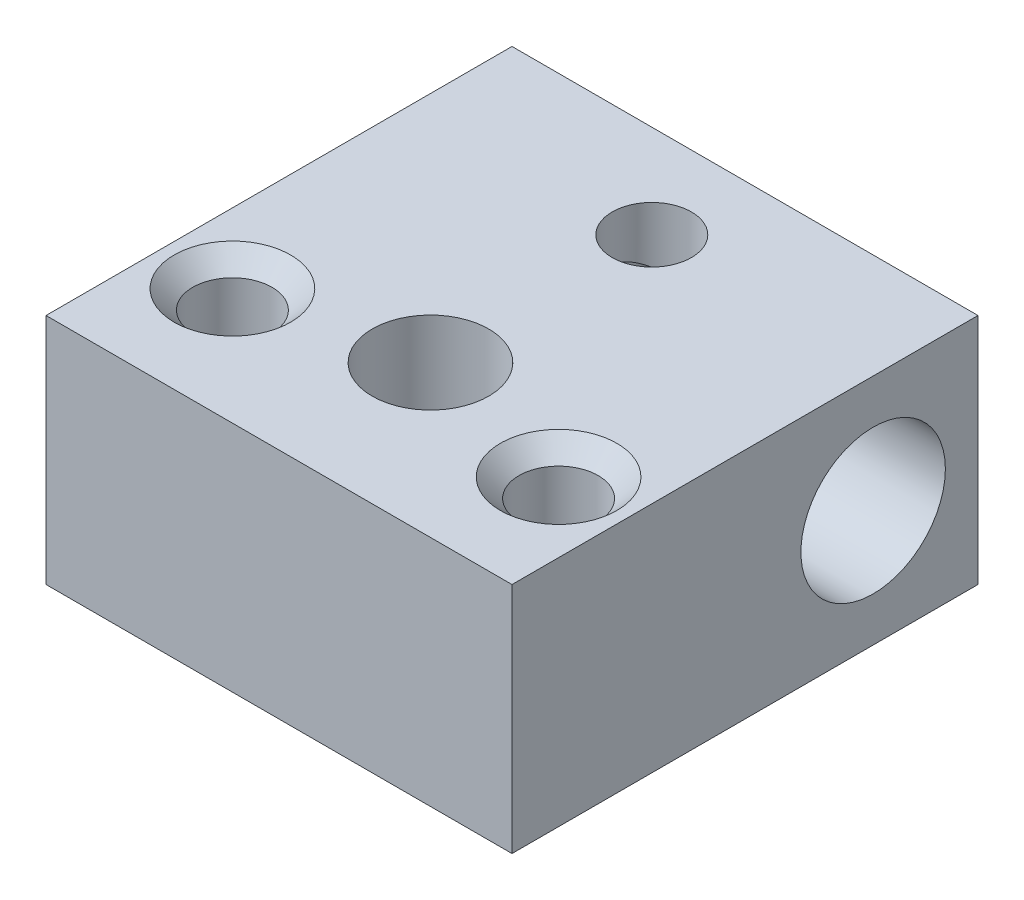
SolidWorks part; units mm, degrees
ref_plane "Alzado" through (0, 0, 0) normal (0, 0, 1) x (1, 0, 0)
ref_plane "Planta" through (0, 0, 0) normal (0, 1, 0) x (1, 0, 0)
ref_plane "Vista lateral" through (0, 0, 0) normal (1, 0, 0) x (0, 0, -1)
sketch "Croquis1" plane through (0, 0, 0) normal (0, 1, 0) x (1, 0, 0)
  line L1 (-10, -10) -> (10, -10)
  line L2 (-10, -10) -> (-10, 10)
  line L3 (-10, 10) -> (10, 10)
  line L4 (10, -10) -> (10, 10)
  line L5 (-10, -10) -> (10, 10) construction
  line L6 (-10, 10) -> (10, -10) construction
  point P0 (0, 0)
  dimension "D1" = 20
  dimension "D2" = 20
extrude "Saliente-Extruir1" add sketch "Croquis1" along normal blind 10
hole_wizard "Perforador para roscar para macho de roscar para M6x1.01" positions "Croquis4" profile "Croquis5" hole size "M6x1.0" standard "Ansi Metric"
sketch "Croquis4" plane through (0, 10, 0) normal (0, 1, 0) x (1, 0, 0)
  line L0 (-10, -10) -> (10, -10) construction
  line L1 (-10, 10) -> (-10, -10) construction
  point P0 (0, -3.5)
  dimension "D1" = 6.5
  dimension "D2" = 10
sketch "Croquis5" plane through (0, 10, 3.5) normal (1, 0, 0) x (0, 0, 1)
  line L0 (0, 0) -> (0, 10)
  line L1 (0, 10) -> (2.5, 10)
  line L2 (2.5, 10) -> (2.5, 0)
  line L5 (2.5, 0) -> (0, 0)
  line L11 (0, -6.35) -> (0, 107.95) construction
  dimension "Diámetro de taladro hasta el siguiente" = 5
  dimension "Profundidad de taladro hasta el siguiente" = 10
thread "Rosca1" pitch 1 start angle 0, offset 0, length 0, pitch 1, diameter 5
ref_plane "Plano1" through (-2.5, 10, 3.5) normal (0, 0, 1) x (-1, 0, 0)
sketch "Perfil de rosca1" plane through (-2.5, 10, 3.5) normal (0, 0, 1) x (-1, 0, 0)
  line L0 (0, 0) -> (0, 1) construction
  line L11 (0, 0) -> (0, 0.875)
  line L12 (0, 0.875) -> (-0.5413, 0.5625)
  line L13 (-0.5413, 0.5625) -> (-0.5413, 0.3125)
  line L15 (-0.5413, 0.3125) -> (0, 0)
  line L17 (-0.5413, 0.4375) -> (0, 0.4375) construction
  point P2 (0, 0)
  dimension "Pitch" = 1
  dimension "Profile_Angle" = 60
  dimension "Profile_Land" = 0.25
  dimension "Profile_Height" = 0.5413
hole_wizard "Refrentado para tornillo tapón con cabeza plana de clavija de M31" positions "Croquis8" profile "Croquis9" countersink size "M3" standard "Ansi Metric"
sketch "Croquis8" plane through (0, 10, 0) normal (0, 1, 0) x (1, 0, 0)
  line L0 (-10, -10) -> (10, -10) construction
  line L2 (-10, 10) -> (-10, -10) construction
  line L3 (10, -10) -> (10, 10) construction
  point P0 (-7, -5)
  point P2 (7, -5)
  dimension "D1" = 5
  dimension "D2" = 5
  dimension "D3" = 3
  dimension "D4" = 3
sketch "Croquis9" plane through (-7, 10, 5) normal (1, 0, 0) x (0, 0, 1)
  line L0 (0, 0) -> (0, 10)
  line L1 (0, 10) -> (1.7, 10)
  line L2 (1.7, 10) -> (1.7, 0.8)
  line L3 (1.7, 0.8) -> (2.5, 0)
  line L5 (2.5, 0) -> (0, 0)
  line L6 (-1.7, 0.8) -> (-2.5, 0) construction
  line L11 (0, -6.35) -> (0, 107.95) construction
  dimension "Diámetro de taladro hasta el siguiente" = 3.4
  dimension "Profundidad de taladro hasta el siguiente" = 10
  dimension "Diámetro de avellanado cercano" = 5
  dimension "Ángulo de avellanado cercano" = 90
hole_wizard "Taladro de margen para M31" positions "Croquis14" profile "Croquis16" hole size "M3" standard "Ansi Metric"
sketch "Croquis14" plane through (0, 10, 0) normal (0, 1, 0) x (1, 0, 0)
  line L0 (10, 10) -> (-10, 10) construction
  line L1 (10, -10) -> (10, 10) construction
  point P0 (0, 6)
  dimension "D1" = 4
  dimension "D2" = 10
sketch "Croquis16" plane through (0, 10, -6) normal (1, 0, 0) x (0, 0, 1)
  line L0 (0, 0) -> (0, 10)
  line L1 (0, 10) -> (1.7, 10)
  line L2 (1.7, 10) -> (1.7, 0)
  line L5 (1.7, 0) -> (0, 0)
  line L11 (0, -6.35) -> (0, 107.95) construction
  dimension "Diámetro de taladro hasta el siguiente" = 3.4
  dimension "Profundidad de taladro hasta el siguiente" = 10
sketch "Croquis17" plane through (10, 0, 0) normal (1, 0, 0) x (0, 0, -1)
  line L0 (-10, 10) -> (-10, 0) construction
  line L1 (-10, 0) -> (10, 0) construction
  circle A0 centre (5.5, 5) radius 3.1
  dimension "D1" = 6.2
  dimension "D2" = 15.5
  dimension "D3" = 5
extrude "Cortar-Extruir1" cut sketch "Croquis17" against normal blind 20
hole_wizard "Taladro de margen para M32" positions "Croquis18" profile "Croquis20" hole size "M3" standard "Ansi Metric"
sketch "Croquis18" plane through (-10, 0, 0) normal (-1, 0, 0) x (0, 0, 1)
  line L0 (10, 10) -> (10, 0) construction
  line L1 (-10, 10) -> (10, 10) construction
  point P0 (0, 5)
  dimension "D1" = 10
  dimension "D2" = 5
sketch "Croquis20" plane through (-10, 5, 0) normal (0, 1, 0) x (0, 0, 1)
  line L0 (0, 0) -> (0, 7)
  line L1 (0, 7) -> (1.7, 7)
  line L2 (1.7, 7) -> (1.7, 0)
  line L5 (1.7, 0) -> (0, 0)
  line L10 (0, 7) -> (-1.7, 7) construction
  line L11 (0, -6.35) -> (0, 107.95) construction
  dimension "Diámetro de taladro" = 3.4
  dimension "Profundidad de taladro" = 7
  dimension "Ángulo de perforador" = 180
sketch "Croquis21" plane through (-10, 0, 0) normal (-1, 0, 0) x (0, 0, 1)
  circle A1 centre (0, 5) radius 1.7 construction
  circle A3 centre (-1.5, 7.75) radius 0.9
  dimension "D4" = 1.8
  dimension "D5" = 2.75
  dimension "D6" = 1.5
extrude "Cortar-Extruir2" cut sketch "Croquis21" against normal blind 2.75
thread "Rosca4" pitch 1 start angle 0, offset 0, length 0, pitch 1, diameter 3.4
ref_plane "Plano4" through (-10, 5, -1.7) normal (0, -1, 0) x (0, 0, -1)
sketch "Perfil de rosca4" plane through (-10, 5, -1.7) normal (0, -1, 0) x (0, 0, -1)
  line L0 (0, 0) -> (0, 1) construction
  line L11 (0, 0) -> (0, 0.875)
  line L12 (0, 0.875) -> (-0.5413, 0.5625)
  line L13 (-0.5413, 0.5625) -> (-0.5413, 0.3125)
  line L15 (-0.5413, 0.3125) -> (0, 0)
  line L17 (-0.5413, 0.4375) -> (0, 0.4375) construction
  point P2 (0, 0)
  dimension "Pitch" = 1
  dimension "Profile_Angle" = 60
  dimension "Profile_Land" = 0.25
  dimension "Profile_Height" = 0.5413
